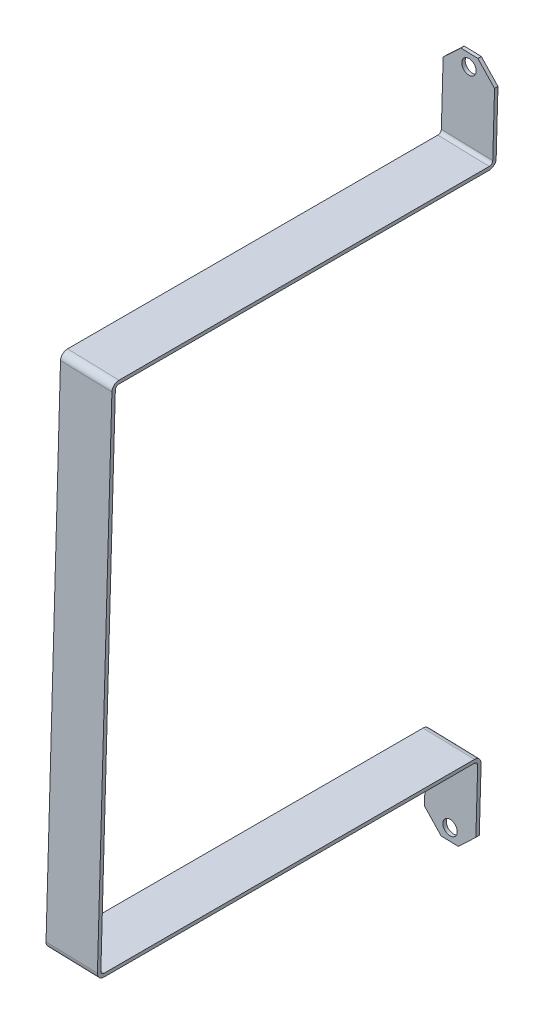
SolidWorks part; units mm, degrees
ref_plane "Plan de face" through (0, 0, 0) normal (0, 0, 1) x (1, 0, 0)
ref_plane "Plan de dessus" through (0, 0, 0) normal (0, 1, 0) x (1, 0, 0)
ref_plane "Plan de droite" through (0, 0, 0) normal (1, 0, 0) x (0, 0, -1)
ref_plane "Plan1" through (-273.7291, 7.7659, 0) normal (0.9996, -0.0284, 0) x (0.0284, 0.9996, 0)
sketch "Esquisse2" plane through (-273.7291, 7.7659, 0) normal (0.9996, -0.0284, 0) x (0.0284, 0.9996, 0)
  line L0 (77.5, 0) -> (101, 0)
  line L2 (101, 0) -> (101, 1)
  line L3 (101, 1) -> (77.5, 1)
  line L4 (76.5, 2) -> (76.5, 110)
  line L5 (75.5, 2) -> (75.5, 110)
  line L7 (-74.5, 111) -> (74.5, 111)
  line L8 (-101, 0) -> (-77.5, 0)
  line L9 (-74.5, 112) -> (74.5, 112)
  line L10 (0, -278.3941) -> (0, 180.6177) construction
  line L12 (-75.5, 2) -> (-75.5, 110)
  line L14 (-76.5, 110) -> (-76.5, 2)
  line L15 (-77.5, 1) -> (-101, 1)
  line L16 (-101, 1) -> (-101, 0)
  arc A0 (75.5, 110) -> (74.5, 111) centre (74.5, 110) ccw
  arc A1 (76.5, 110) -> (74.5, 112) centre (74.5, 110) ccw
  arc A2 (77.5, 0) -> (75.5, 2) centre (77.5, 2) cw
  arc A3 (77.5, 1) -> (76.5, 2) centre (77.5, 2) cw
  arc A4 (-75.5, 110) -> (-74.5, 111) centre (-74.5, 110) cw
  arc A5 (-76.5, 2) -> (-77.5, 1) centre (-77.5, 2) cw
  arc A6 (-77.5, 0) -> (-75.5, 2) centre (-77.5, 2) ccw
  arc A7 (-74.5, 112) -> (-76.5, 110) centre (-74.5, 110) ccw
  point P22 (75.5, 0)
  point P38 (-75.5, 0)
  dimension "D5" = 1
  dimension "D6" = 2
  dimension "D7" = 1
  dimension "D11" = 1
  dimension "D12" = 2
  dimension "D2" = 1
  dimension "D3" = 1
  dimension "D4" = 1
  dimension "D8" = 1
  dimension "D9" = 75.5
  dimension "D10" = 1
  dimension "D13" = 101
  dimension "D14" = 101
  dimension "D15" = 111
  dimension "D16" = 75.5
extrude "Extrusion1" add sketch "Esquisse2" along normal mid plane 15
sketch "Esquisse3" plane through (0, 0, 1) normal (0, 0, 1) x (1, 0, 0)
  line L0 (-279.1133, 82.4486) -> (-283.3389, -66.4914) construction
  line L2 (-269.0964, -93.4062) -> (-284.0904, -92.9808) construction
  circle A0 centre (-276.4941, -89.6949) radius 2.1
  circle A1 centre (-270.9641, 105.2267) radius 2.1
  dimension "D1" = 4.2
  dimension "D2" = 4.2
  dimension "D3" = 195
  dimension "D4" = 3.5
  dimension "D5" = 7.5
  dimension "D6" = 7.5
extrude "Enlèv. mat.-Extru.1" cut sketch "Esquisse3" against normal through all
chamfer "Chanfrein1" distance 5 angle 45 4 edges at (-263.3678, 108.5126, 0.5) (-278.3618, 108.938, 0.5) (-284.0904, -92.9808, 0.5) (-269.0964, -93.4062, 0.5)
